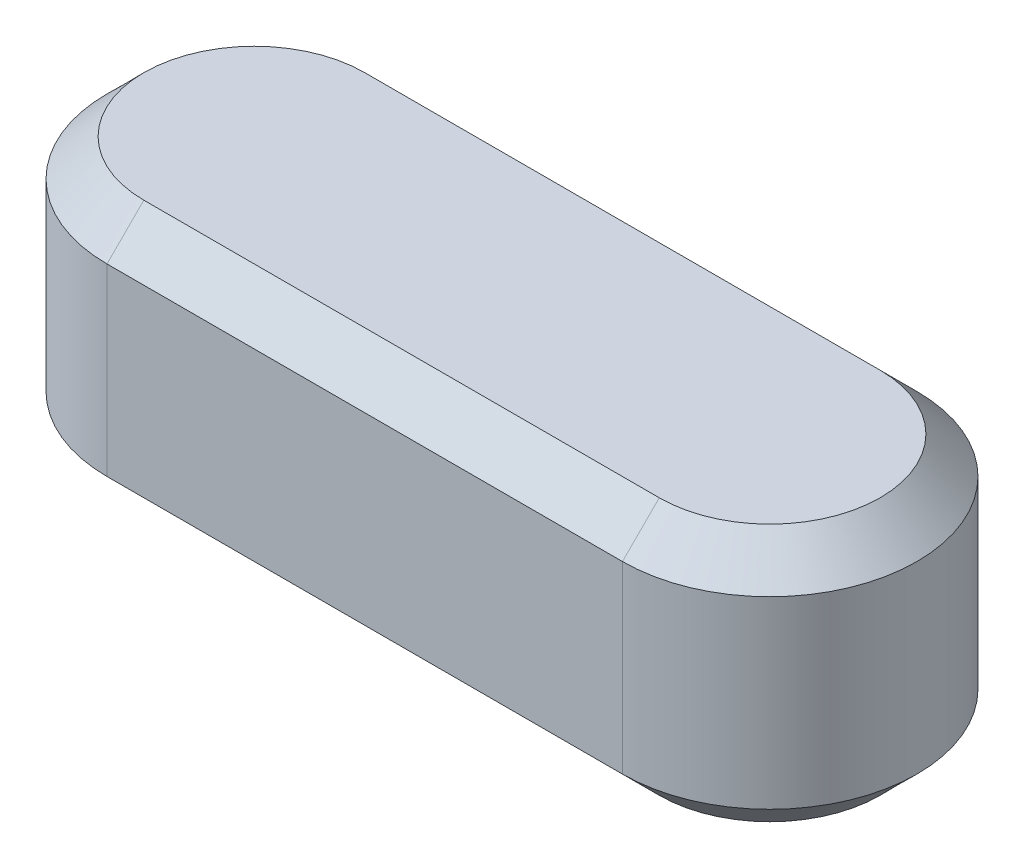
SolidWorks part; units mm, degrees
ref_plane "Ebene vorne" through (0, 0, 0) normal (0, 0, 1) x (1, 0, 0)
ref_plane "Ebene oben" through (0, 0, 0) normal (0, 1, 0) x (1, 0, 0)
ref_plane "Ebene rechts" through (0, 0, 0) normal (1, 0, 0) x (0, 0, -1)
sketch "Skizze2" plane through (0, 0, 0) normal (0, 1, 0) x (1, 0, 0)
  line L0 (0, 0) -> (14, 0) construction
  line L1 (0, 4) -> (14, 4)
  line L2 (0, -4) -> (14, -4)
  arc A0 (0, 4) -> (0, -4) centre (0, 0) ccw
  arc A1 (14, -4) -> (14, 4) centre (14, 0) ccw
  point P3 (7, 0)
  dimension "länge" = 14
  dimension "breite" = 8
extrude "Aufsatz-Linear austragen1" add sketch "Skizze2" along normal blind 7
chamfer "Fase1" distance 1 angle 45 8 edges at (18, 0, 0) (7, 0, -4) (7, 0, 4) (-4, 0, 0) (18, 7, 0) (7, 7, -4) (7, 7, 4) (-4, 7, 0)
